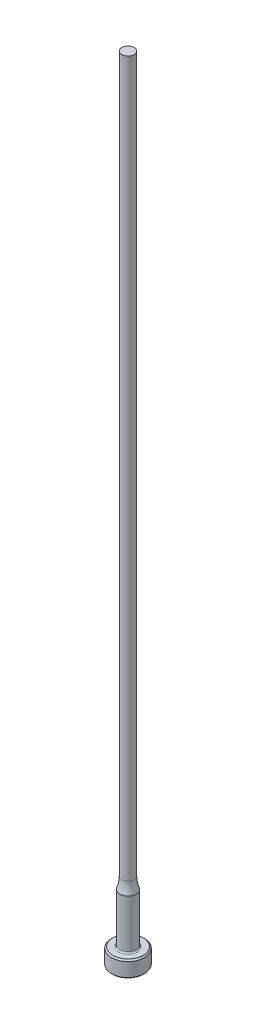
SolidWorks part; units mm, degrees
ref_plane "Front Plane" through (0, 0, 0) normal (0, 0, 1) x (1, 0, 0)
ref_plane "Top Plane" through (0, 0, 0) normal (0, 1, 0) x (1, 0, 0)
ref_plane "Right Plane" through (0, 0, 0) normal (1, 0, 0) x (0, 0, -1)
sketch "Sketch1" plane through (0, 0, 0) normal (0, 0, 1) x (1, 0, 0)
  line L0 (0, 259.9588) -> (0, -15.1925) construction
  line L1 (0, 0) -> (-3.175, 0)
  line L2 (-3.175, 0) -> (-3.175, 3.175)
  line L3 (-3.175, 3.175) -> (-1.5875, 3.175)
  line L4 (-1.19, 14.9114) -> (-1.19, 152.4)
  line L5 (-1.19, 152.4) -> (0, 152.4)
  line L6 (0, 152.4) -> (0, 0)
  line L7 (-1.5875, 3.175) -> (-1.5875, 12.7)
  arc A0 (-1.5875, 12.7) -> (-1.19, 14.9114) centre (-7.54, 14.9114) ccw
  point P13 (-1.5875, 0)
  dimension "D1" = 6.35
  dimension "L" = 152.4
  dimension "D2" = 3.175
  dimension "H" = 6.35
  dimension "T" = 3.175
  dimension "D" = 2.38
  dimension "S" = 12.7
revolve "Revolve1" add sketch "Sketch1" angle 360 about L0
chamfer "Chamfer1" distance 0.254 angle 45 2 edges at (0, 3.175, 3.175) (0, 0, 3.175)
fillet "Fillet1" radius 0.254 1 edges at (0, 3.175, 1.5875)
